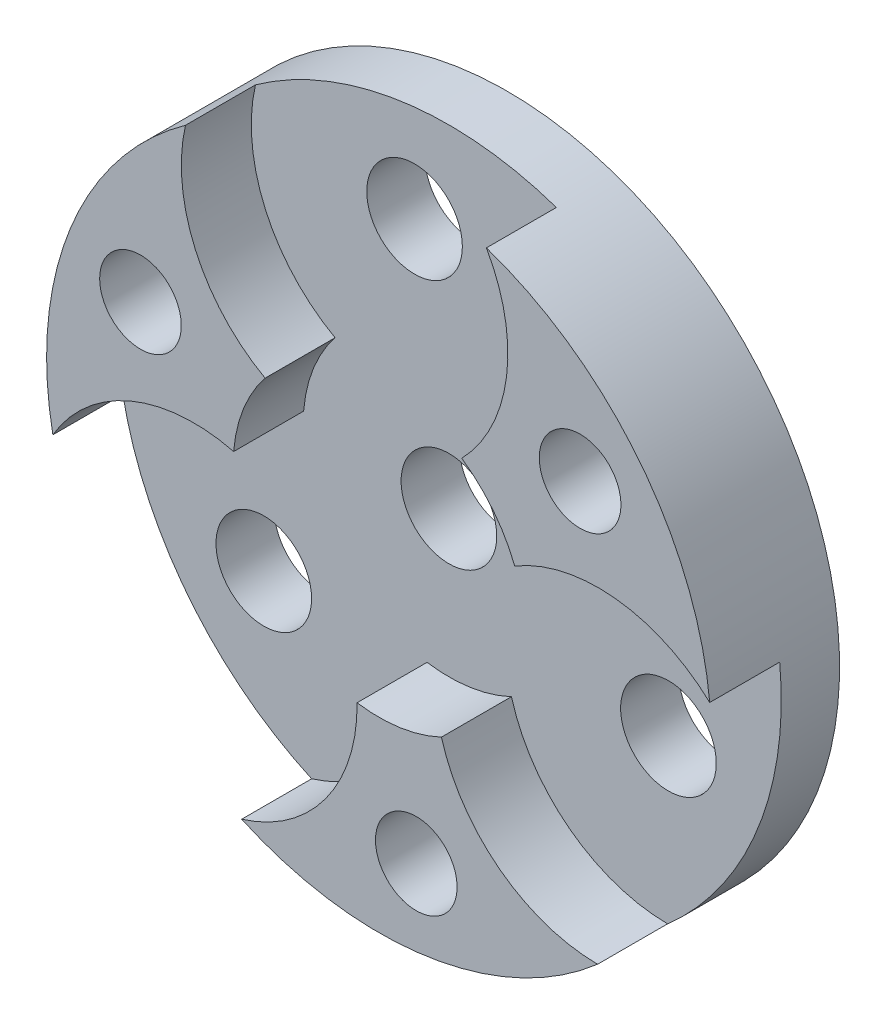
SolidWorks part; units mm, degrees
ref_plane "Plan de face" through (0, 0, 0) normal (0, 0, 1) x (1, 0, 0)
ref_plane "Plan de dessus" through (0, 0, 0) normal (0, 1, 0) x (1, 0, 0)
ref_plane "Plan de droite" through (0, 0, 0) normal (1, 0, 0) x (0, 0, -1)
ref_plane "Plan4" through (0, 0, 0) normal (0, -1, 0) x (1, 0, 0)
sketch "Esquisse1" plane through (0, 0, 0) normal (0, -1, 0) x (1, 0, 0)
  line L0 (2.85, 3.65) -> (0, 3.65)
  line L1 (0, 3.65) -> (0, 2.55)
  line L2 (0, 2.55) -> (2.85, 2.55)
  line L3 (2.85, 2.55) -> (2.85, 3.65)
  line L4 (0, 3.65) -> (0, 2.55) construction
revolve "Révolution1" add sketch "Esquisse1" angle 360 about L4
sketch "Esquisse2" plane through (0, 0, 3.65) normal (0, 0, 1) x (1, 0, 0)
  arc A0 (-1.6591, 2.3173) -> (-0.9763, 0.7806) centre (-0.2947, 2.0034) ccw
  arc A1 (-0.9763, 0.7806) -> (-1.2459, 0.1007) centre (0, 0) ccw
  arc A2 (-1.2459, 0.1007) -> (-2.7963, -0.5505) centre (-1.5877, -1.257) ccw
  arc A3 (-2.7963, -0.5505) -> (-1.6591, 2.3173) centre (0, 0) ccw
extrude "Enlèv. mat.-Extru.1" cut sketch "Esquisse2" against normal blind 0.6
sketch "Esquisse3" plane through (0, 0, 3.05) normal (0, 0, 1) x (1, 0, 0)
  arc A0 (1.1642, 0.4552) -> (0.7102, 1.0287) centre (0, 0) ccw
  arc A1 (0.7102, 1.0287) -> (0.9215, 2.6969) centre (-0.2947, 2.0034) ccw
  arc A2 (0.9215, 2.6969) -> (2.8364, 0.2781) centre (0, 0) cw
  arc A3 (2.8364, 0.2781) -> (1.1642, 0.4552) centre (1.8824, -0.7465) ccw
extrude "Boss.-Extru.1" add sketch "Esquisse3" along normal blind 0.6
sketch "Esquisse4" plane through (0, 0, 3.05) normal (0, 0, 1) x (1, 0, 0)
  arc A0 (-0.1878, -1.2358) -> (0.5358, -1.1294) centre (0, 0) ccw
  arc A1 (0.5358, -1.1294) -> (1.8749, -2.1465) centre (1.8824, -0.7465) ccw
  arc A2 (1.8749, -2.1465) -> (-1.1773, -2.5955) centre (0, 0) cw
  arc A3 (-1.1773, -2.5955) -> (-0.1878, -1.2358) centre (-1.5877, -1.257) ccw
extrude "Boss.-Extru.2" add sketch "Esquisse4" along normal blind 0.6
hole_wizard "Perçage1" positions "Esquisse6" profile "Esquisse5" legacy
sketch "Esquisse6" plane through (0, 0, 3.05) normal (0, 0, 1) x (1, 0, 0)
  point P0 (-0.2947, 2.0034)
  point P1 (-1.5877, -1.257)
  point P2 (1.8824, -0.7465)
  point P3 (0, 0)
sketch "Esquisse5" plane through (-0.2947, 2.0034, 3.05) normal (1, 0, 0) x (0, -1, 0)
  line L0 (0, 0) -> (0, 0.5)
  line L1 (0, 0.5) -> (0.41, 0.5)
  line L2 (0.41, 0.5) -> (0.41, 0)
  line L3 (0.41, 0) -> (0, 0)
  line L4 (0, 110) -> (0, -10) construction
  dimension "Diamètre" = 0.82
  dimension "Profondeur" = 0.5
hole_wizard "Diamètre du perçage Ø0.7 (0.7)1" positions "Esquisse8" profile "Esquisse7" hole size "Ø0.7" standard "Ansi Métrique"
sketch "Esquisse8" plane through (0, 0, 2.55) normal (0, 0, -1) x (-1, 0, 0)
  point P0 (-1.7249, 1.3656)
  point P1 (2.0451, 0.811)
  point P2 (-0.3202, -2.1766)
sketch "Esquisse7" plane through (1.7249, 1.3656, 2.55) normal (1, 0, 0) x (0, 1, 0)
  line L0 (0, 0) -> (0, 1.1)
  line L1 (0, 1.1) -> (0.35, 1.1)
  line L2 (0.35, 1.1) -> (0.35, 0)
  line L5 (0.35, 0) -> (0, 0)
  line L11 (0, -6.35) -> (0, 107.95) construction
  dimension "Diamètre du perçage jusqu'au prochain" = 0.7
  dimension "Profondeur du perçage jusqu'au prochain" = 1.1
